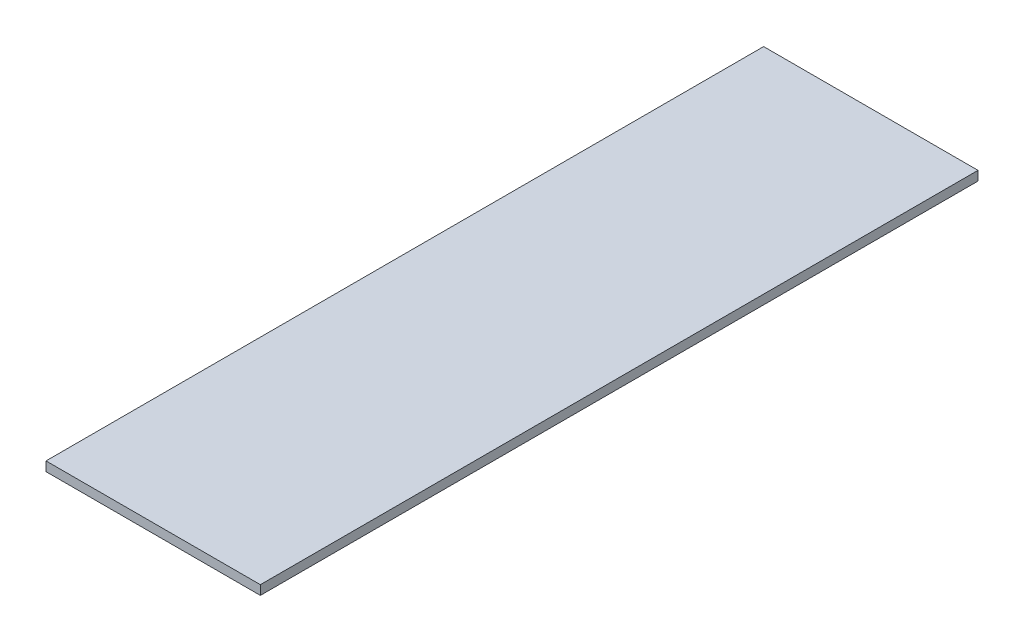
SolidWorks part; units mm, degrees
ref_plane "Front Plane" through (0, 0, 0) normal (0, 0, 1) x (1, 0, 0)
ref_plane "Top Plane" through (0, 0, 0) normal (0, 1, 0) x (1, 0, 0)
ref_plane "Right Plane" through (0, 0, 0) normal (1, 0, 0) x (0, 0, -1)
sketch "Sketch1" plane through (0, 0, 0) normal (0, 1, 0) x (1, 0, 0)
  line L0 (0, 0) -> (0, -977.9)
  line L1 (0, -977.9) -> (-292.1, -977.9)
  line L2 (-292.1, -977.9) -> (-292.1, 0)
  line L3 (-292.1, 0) -> (0, 0)
  dimension "D1" = 977.9
  dimension "D3" = 292.1
extrude "Boss-Extrude1" add sketch "Sketch1" along normal blind 12.7
